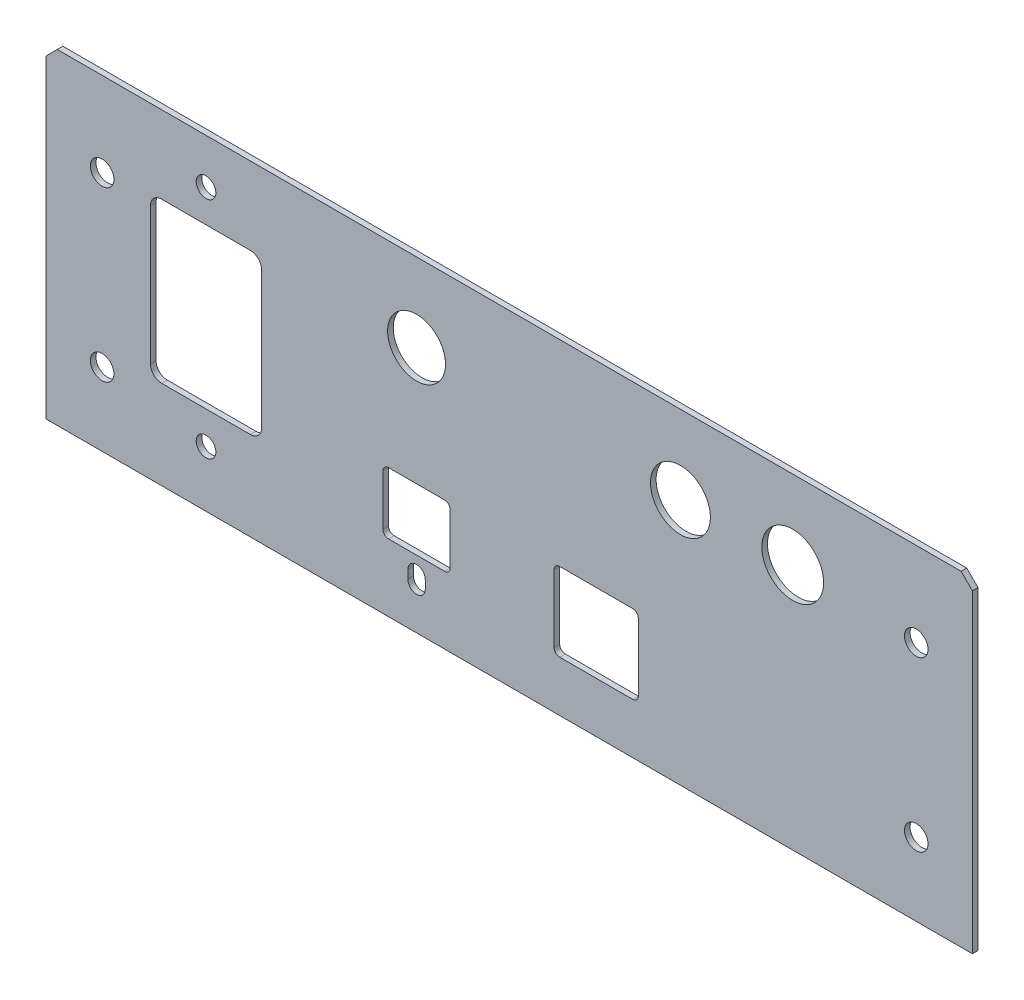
SolidWorks part; units mm, degrees
ref_plane "Front Plane" through (0, 0, 0) normal (0, 0, 1) x (1, 0, 0)
ref_plane "Top Plane" through (0, 0, 0) normal (0, 1, 0) x (1, 0, 0)
ref_plane "Right Plane" through (0, 0, 0) normal (1, 0, 0) x (0, 0, -1)
sketch "Sketch1" plane through (0, 0, 0) normal (0, 0, 1) x (1, 0, 0)
  line L0 (-80.5, 29) -> (-82.5, 27)
  line L1 (-80.5, 29) -> (80.5, 29)
  line L2 (-82.5, 27) -> (-82.5, -29)
  line L3 (-82.5, -29) -> (82.5, -29)
  line L4 (82.5, 27) -> (82.5, -29)
  line L5 (-82.5, 29) -> (82.5, -29) construction
  line L6 (-82.5, -29) -> (82.5, 29) construction
  line L7 (80.5, 29) -> (82.5, 27)
  point P0 (0, 0)
  dimension "D1" = 58
  dimension "D2" = 165
base flange "Base-Flange1" sketch "Sketch1" thickness 1 reverse thickness direction no parameters "D1"=0.7366
sketch "Sketch7" plane through (0, 0, 0) normal (0, 0, 1) x (1, 0, 0)
  line L0 (80.5, 29) -> (-80.5, 29) construction
  line L1 (-61.9, 15.2) -> (-46.1, 15.2)
  line L2 (-63.9, 13.2) -> (-63.9, -11.2)
  line L3 (-61.9, -13.2) -> (-46.1, -13.2)
  line L4 (-44.1, 13.2) -> (-44.1, -11.2)
  line L5 (-63.9, 15.2) -> (-44.1, -13.2) construction
  line L6 (-63.9, -13.2) -> (-44.1, 15.2) construction
  line L11 (-82.5, 27) -> (-82.5, -29) construction
  circle A0 centre (-54, 21) radius 1.75
  circle A1 centre (-54, -19) radius 1.75
  arc A2 (-63.9, 13.2) -> (-61.9, 15.2) centre (-61.9, 13.2) cw
  arc A3 (-44.1, 13.2) -> (-46.1, 15.2) centre (-46.1, 13.2) ccw
  arc A4 (-63.9, -11.2) -> (-61.9, -13.2) centre (-61.9, -11.2) ccw
  arc A5 (-46.1, -13.2) -> (-44.1, -11.2) centre (-46.1, -11.2) ccw
  point P0 (-54, 1)
  dimension "D5" = 3.5
  dimension "D8" = 2
  dimension "D1" = 28
  dimension "D2" = 28.4
  dimension "D3" = 19.8
  dimension "D4" = 28.5
  dimension "D6" = 20
  dimension "D7" = 2
extrude "Cut-Extrude1" cut sketch "Sketch7" against normal up to next
sketch "Sketch8" plane through (0, 0, 0) normal (0, 0, 1) x (1, 0, 0)
  line L0 (80.5, 29) -> (-80.5, 29) construction
  line L1 (82.5, -29) -> (82.5, 27) construction
  circle A0 centre (50.5, 15) radius 5.5
  circle A1 centre (30.5, 15) radius 5.335
  circle A2 centre (-16.5, 15) radius 5.1547
  dimension "D1" = 11
  dimension "D2" = 14
  dimension "D3" = 32
  dimension "D4" = 20
  dimension "D5" = 47
extrude "Cut-Extrude2" cut sketch "Sketch8" against normal up to next
sketch "Sketch10" plane through (0, 0, 0) normal (0, 0, 1) x (1, 0, 0)
  line L0 (-82.5, 27) -> (-82.5, -29) construction
  line L1 (-75, -26) -> (-60, -26) construction
  line L2 (82.5, -29) -> (82.5, 27) construction
  line L3 (6.5, -9) -> (18.5, -9) construction
  line L4 (9, -6) -> (22, -6)
  line L5 (8, -7) -> (8, -19)
  line L6 (9, -20) -> (22, -20)
  line L7 (23, -7) -> (23, -19)
  line L8 (8, -6) -> (23, -20) construction
  line L9 (8, -20) -> (23, -6) construction
  line L10 (-16.5, -21.5) -> (-16.5, -20) construction
  line L11 (82.5, -29) -> (82.5, 27) construction
  line L12 (-82.5, -29) -> (82.5, -29) construction
  line L13 (-21.5, -6) -> (-11.5, -6)
  line L14 (-22.5, -7) -> (-22.5, -16)
  line L15 (-21.5, -17) -> (-11.5, -17)
  line L16 (-10.5, -7) -> (-10.5, -16)
  line L17 (-22.5, -6) -> (-10.5, -17) construction
  line L18 (-22.5, -17) -> (-10.5, -6) construction
  line L19 (-82.5, 27) -> (-82.5, -29) construction
  line L20 (-18.05, -21.5) -> (-18.05, -20)
  line L21 (-14.95, -21.5) -> (-14.95, -20)
  arc A0 (-18.05, -21.5) -> (-14.95, -21.5) centre (-16.5, -21.5) ccw
  arc A1 (-14.95, -20) -> (-18.05, -20) centre (-16.5, -20) ccw
  circle A2 centre (72.5, -16) radius 2.1
  circle A3 centre (-72.5, -16) radius 2.1
  arc A5 (-21.5, -6) -> (-22.5, -7) centre (-21.5, -7) ccw
  arc A6 (-22.5, -16) -> (-21.5, -17) centre (-21.5, -16) ccw
  arc A7 (-11.5, -17) -> (-10.5, -16) centre (-11.5, -16) ccw
  arc A8 (-10.5, -7) -> (-11.5, -6) centre (-11.5, -7) ccw
  arc A9 (8, -19) -> (9, -20) centre (9, -19) ccw
  arc A10 (22, -20) -> (23, -19) centre (22, -19) ccw
  arc A11 (23, -7) -> (22, -6) centre (22, -7) ccw
  arc A12 (9, -6) -> (8, -7) centre (9, -7) ccw
  circle A13 centre (-72.5, 14) radius 2.1
  circle A14 centre (72.5, 14) radius 2.1
  point P0 (-16.5, -20.75)
  point P17 (12.5, -14.5)
  point P25 (-16.5, -11.5)
  dimension "D1" = 4.2
  dimension "D13" = 1.55
  dimension "D15" = 1
  dimension "D16" = 30
  dimension "D2" = 10
  dimension "D3" = 10
  dimension "D4" = 10
  dimension "D5" = 15
  dimension "D6" = 14
  dimension "D7" = 3
  dimension "D8" = 59.5
  dimension "D9" = 11
  dimension "D10" = 12
  dimension "D11" = 12
  dimension "D12" = 60
  dimension "D14" = 1.5
  dimension "D17" = 3
extrude "Cut-Extrude3" cut sketch "Sketch10" against normal up to next
sketch "Bend-Lines1" [suppressed] plane through (0, 0, 0) normal (0, 1, 0) x (1, 0, 0)
sketch "Bounding-Box1" [suppressed] plane through (0, 0, 0) normal (0, 1, 0) x (1, 0, 0)
sheet metal parameters "Sheet-Metal1" thickness 1 parameters "D1"=0.7366
flat pattern "Flat-Pattern1"
sketch "Bend-Lines2" plane through (0, 0, 0) normal (0, 1, 0) x (1, 0, 0)
sketch3d "Bounding-Box2" [suppressed]
  line L0 (80, -30, 0) -> (-80, -30, 0) construction
  line L1 (80, 30, 0) -> (-80, 30, 0) construction
  line L2 (80, -30, 0) -> (80, 30, 0) construction
  line L3 (-80, -30, 0) -> (-80, 30, 0) construction
sheet metal parameters "Sheet-Metal2" thickness 1 parameters "D1"=0.7366
flat pattern "Flat-Pattern1"
sketch "Bend-Lines2" plane through (0, 0, 0) normal (0, 1, 0) x (1, 0, 0)
sketch3d "Bounding-Box2" [suppressed]
  line L0 (-75, -30, 0) -> (75, -30, 0) construction
  line L1 (-75, 30, 0) -> (75, 30, 0) construction
  line L2 (-75, -30, 0) -> (-75, 30, 0) construction
  line L3 (75, -30, 0) -> (75, 30, 0) construction
sheet metal parameters "Sheet-Metal3" thickness 1 parameters "D1"=0.7366
flat pattern "Flat-Pattern1"
sketch "Bend-Lines2" plane through (0, 0, 0) normal (0, 1, 0) x (1, 0, 0)
sketch3d "Bounding-Box2" [suppressed]
  line L0 (-75, -30, 0) -> (75, -30, 0) construction
  line L1 (-75, 30, 0) -> (75, 30, 0) construction
  line L2 (-75, -30, 0) -> (-75, 30, 0) construction
  line L3 (75, -30, 0) -> (75, 30, 0) construction
sheet metal parameters "Sheet-Metal4" thickness 1 parameters "D1"=0.7366
flat pattern "Flat-Pattern1"
sketch "Bend-Lines2" plane through (0, 0, 0) normal (0, 1, 0) x (1, 0, 0)
sketch3d "Bounding-Box2" [suppressed]
  line L0 (-82.5, -29, 0) -> (82.5, -29, 0) construction
  line L1 (-82.5, 29, 0) -> (82.5, 29, 0) construction
  line L2 (-82.5, -29, 0) -> (-82.5, 29, 0) construction
  line L3 (82.5, -29, 0) -> (82.5, 29, 0) construction
